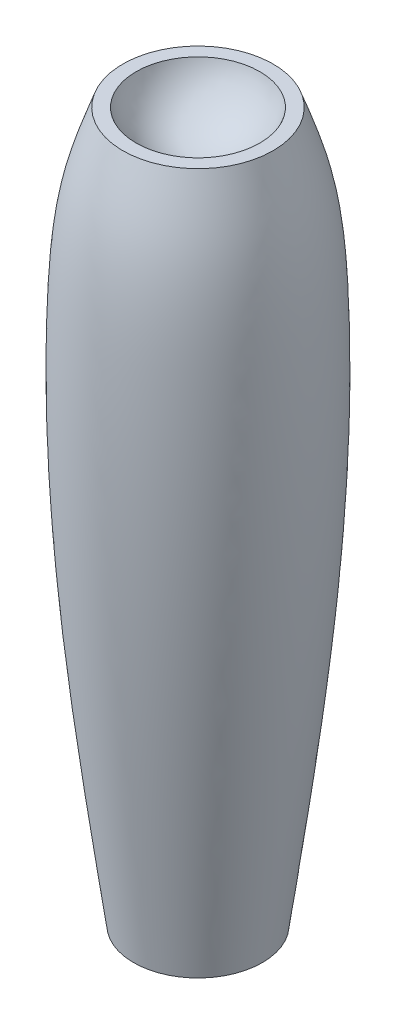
SolidWorks part; units mm, degrees
ref_plane "Plan de face" through (0, 0, 0) normal (0, 0, 1) x (1, 0, 0)
ref_plane "Plan de dessus" through (0, 0, 0) normal (0, 1, 0) x (1, 0, 0)
ref_plane "Plan de droite" through (0, 0, 0) normal (1, 0, 0) x (0, 0, -1)
sketch "Esquisse1" plane through (0, 0, 0) normal (0, 0, 1) x (1, 0, 0)
  line L0 (0, 64.0566) -> (0, -59.0652) construction
  line L1 (-36, 0) -> (0, 0)
  line L2 (0, 0) -> (0, 396)
  line L3 (0, 396) -> (-42, 396)
  spline_without_curve S0
  dimension "D1" = 396
  dimension "D2" = 84
  dimension "D3" = 72
revolve "Révolution1" add sketch "Esquisse1" angle 360 about L2
sketch "Esquisse2" plane through (0, 0, 0) normal (0, 0, 1) x (1, 0, 0)
  line L0 (0, -23.3999) -> (0, 443.3535) construction
  line L1 (42, 396) -> (-42, 396) construction
  line L2 (0, 370) -> (0, 442)
  arc A0 (0, 370) -> (0, 442) centre (0, 406) ccw
  dimension "D1" = 72
  dimension "D2" = 10
revolve "Enlèvement de matière-Révolution1" cut sketch "Esquisse2" angle 360 about L0
sketch "Esquisse3" plane through (0, 0, 0) normal (0, 0, 1) x (1, 0, 0)
  line L0 (0, -37) -> (0, 17)
  line L1 (0, -45.9847) -> (0, 98.4214) construction
  arc A0 (0, 17) -> (0, -37) centre (0, -10) ccw
  dimension "D1" = 54
  dimension "D2" = 10
revolve "Enlèvement de matière-Révolution2" cut sketch "Esquisse3" angle 360 about L1
